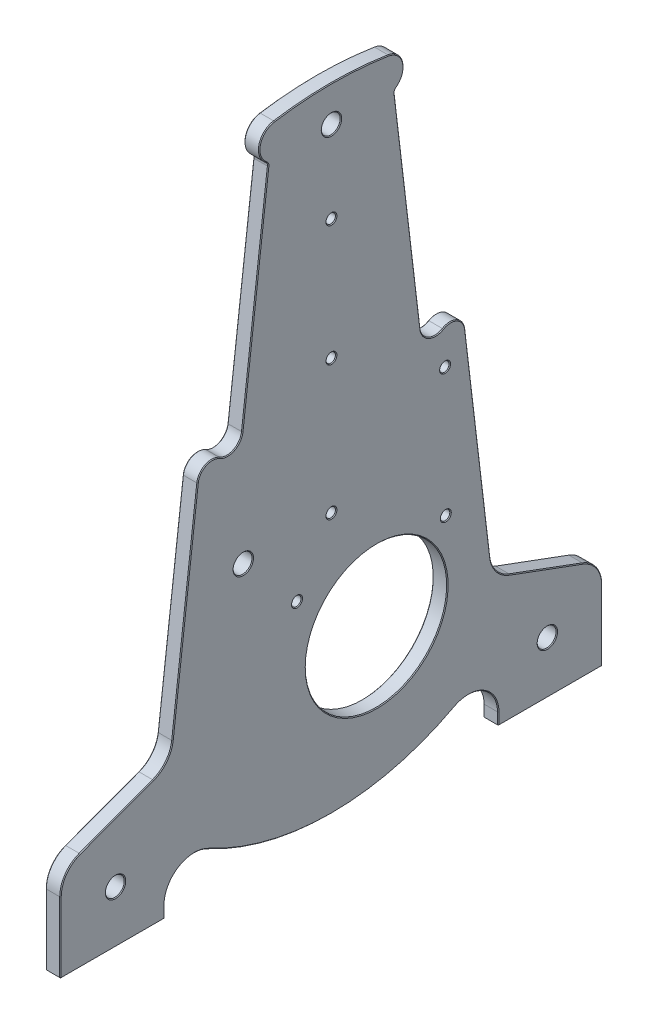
SolidWorks part; units mm, degrees
ref_plane "Спереди" through (0, 0, 0) normal (0, 0, 1) x (1, 0, 0)
ref_plane "Сверху" through (0, 0, 0) normal (0, 1, 0) x (1, 0, 0)
ref_plane "Справа" through (0, 0, 0) normal (1, 0, 0) x (0, 0, -1)
sketch "Эскиз1" plane through (0, 0, 0) normal (1, 0, 0) x (0, 0, -1)
  line L0 (0, 250) -> (0, -250) construction
  line L1 (-42.3, 224.644) -> (-59.901, 77.0376)
  line L2 (168.9387, -113.7422) -> (119.702, -95.529)
  line L3 (-112, -180) -> (-182, -180)
  line L4 (-182, -180) -> (-182, -132.5)
  line L5 (0, 250) -> (-416.5081, 250) construction
  line L6 (-112, -180) -> (-112, -171.9331)
  line L7 (112, -180) -> (112, -171.9331)
  line L8 (112, -180) -> (182, -180)
  line L9 (182, -180) -> (182, -132.5)
  line L10 (-188.6302, 71) -> (0, 71) construction
  line L11 (-89.9297, 62.184) -> (-106.7814, -79.1393)
  line L12 (-168.9387, -113.7422) -> (-119.702, -95.529)
  line L13 (89.9297, 62.184) -> (106.7814, -79.1393)
  line L14 (42.3, 224.644) -> (59.901, 77.0376)
  arc A0 (-74.9153, 69.6108) -> (-89.9297, 62.184) centre (-80, 61) ccw
  circle A1 centre (0, 0) radius 3.175
  circle A2 centre (0, 90) radius 3.175
  circle A3 centre (0, 171) radius 3.175
  circle A4 centre (0, 226) radius 6.35
  arc A5 (38.3929, 247.0344) -> (-38.3929, 247.0344) centre (0, 0) ccw
  arc A6 (-38.3929, 247.0344) -> (-42.3, 224.644) centre (-36.55, 235.1767) ccw
  arc A7 (38.3929, 247.0344) -> (42.3, 224.644) centre (36.55, 235.1767) cw
  circle A8 centre (76.32, 46.6153) radius 3.175
  circle A9 centre (76.81, -39.9973) radius 3.175
  circle A10 centre (0, 0) radius 86.6 construction
  circle A11 centre (0, 0) radius 89.43 construction
  arc A12 (-82.5641, -154.299) -> (-112, -171.9331) centre (-92, -171.9331) ccw
  arc A13 (-82.5641, -154.299) -> (82.5641, -154.299) centre (0, 0) ccw
  circle A14 centre (-145, -145) radius 6.35
  arc A15 (-168.9387, -113.7422) -> (-182, -132.5) centre (-162, -132.5) ccw
  arc A16 (-119.702, -95.529) -> (-106.7814, -79.1393) centre (-126.6408, -76.7712) ccw
  arc A17 (82.5641, -154.299) -> (112, -171.9331) centre (92, -171.9331) cw
  circle A18 centre (145, -145) radius 6.35
  arc A19 (168.9387, -113.7422) -> (182, -132.5) centre (162, -132.5) cw
  arc A20 (119.702, -95.529) -> (106.7814, -79.1393) centre (126.6408, -76.7712) cw
  arc A21 (-74.9153, 69.6108) -> (-59.901, 77.0376) centre (-69.8307, 78.2216) ccw
  arc A22 (74.9153, 69.6108) -> (89.9297, 62.184) centre (80, 61) cw
  arc A23 (74.9153, 69.6108) -> (59.901, 77.0376) centre (69.8307, 78.2216) cw
  circle A24 centre (30.38, -81.0963) radius 47.5
  circle A25 centre (-59.2, 0) radius 6.35
  circle A26 centre (-23.12, -40) radius 3.175
  dimension "D2" = 6.35
  dimension "D6" = 12.7
  dimension "D7" = 500
  dimension "D10" = 24
  dimension "D13" = 173.2
  dimension "D15" = 178.86
  dimension "D19" = 40
  dimension "D20" = 12.7
  dimension "D24" = 40
  dimension "D26" = 20
  dimension "D27" = 175
  dimension "D30" = 95
  dimension "D3" = 90
  dimension "D4" = 81
  dimension "D5" = 55
  dimension "D8" = 36.55
  dimension "D9" = 6.8
  dimension "D11" = 84.6
  dimension "D12" = 76.81
  dimension "D14" = 76.32
  dimension "D16" = 430
  dimension "D17" = 364
  dimension "D18" = 70
  dimension "D21" = 35
  dimension "D22" = 290
  dimension "D23" = 47.5
  dimension "D25" = 251
  dimension "D28" = 20.3
  dimension "D29" = 80
  dimension "D31" = 30.38
  dimension "D32" = 59.2
  dimension "D33" = 23.12
  dimension "D34" = 40
extrude "Бобышка-Вытянуть1" add sketch "Эскиз1" along normal blind 10
fillet "Скругление1" radius 3 2 edges at (5, 224.644, -42.3) (5, 224.644, 42.3)
chamfer "Фаска1" distance 0.5 angle 45 82 edges at (0, -40, 19.945) (0, -81.0963, -77.88) (0, -145, 138.65) (0, 46.6153, -79.495) (0, 171, -3.175) (0, 0, -3.175) (0, 90, -3.175) (0, 226, -6.35) (0, -39.9973, -79.985) (0, -145, -138.65) (0, 0, 52.85) (10, -40, 19.945) (10, -81.0963, -77.88) (10, -145, 138.65) (10, 46.6153, -79.495) (10, 171, -3.175) (10, 0, -3.175) (5, -180, 182) (5, -180, 112) (5, -180, -112) (0, 250, 0) (0, 238.0595, 48.1986) (0, 224.3257, 42.7449) (0, 149.9111, 51.2114) (0, 69.2582, 65.397) (0, 69.9634, 84.4337) (0, -8.4776, 98.3556) (0, -89.1531, 110.9344) (0, -104.6356, 144.3204) (0, -121.0714, 178.413) (0, -156.25, 182) (0, -180, 147) (0, -175.9666, 112) (0, -154.7762, 102.2782) (0, -175, 0) (0, -154.7762, -102.2782) (0, -175.9666, -112) (0, -180, -147) (0, 238.0595, -48.1986) (0, 224.3257, -42.7449) (0, 149.9111, -51.2114) (0, 69.2582, -65.397) (0, 69.9634, -84.4337) (0, -8.4776, -98.3556) (0, -89.1531, -110.9344) (0, -104.6356, -144.3204) (0, -121.0714, -178.413) (0, -156.25, -182) (5, -180, -182) (10, 69.2582, -65.397) (10, 69.9634, -84.4337) (10, -8.4776, -98.3556) (10, -89.1531, -110.9344) (10, -104.6356, -144.3204) (10, -121.0714, -178.413) (10, -156.25, -182) (10, -180, -147) (10, -175.9666, -112) (10, -154.7762, -102.2782) (10, -175, 0) (10, -154.7762, 102.2782) (10, -175.9666, 112) (10, -180, 147) (10, -156.25, 182) (10, -121.0714, 178.413) (10, -104.6356, 144.3204) (10, -89.1531, 110.9344) (10, -8.4776, 98.3556) (10, 69.9634, 84.4337) (10, 69.2582, 65.397) (10, 149.9111, 51.2114) (10, 224.3257, 42.7449) (10, 238.0595, 48.1986) (10, 250, 0) (10, 238.0595, -48.1986) (10, 224.3257, -42.7449) (10, 149.9111, -51.2114) (10, 90, -3.175) (10, 226, -6.35) (10, -39.9973, -79.985) (10, -145, -138.65) (10, 0, 52.85)
